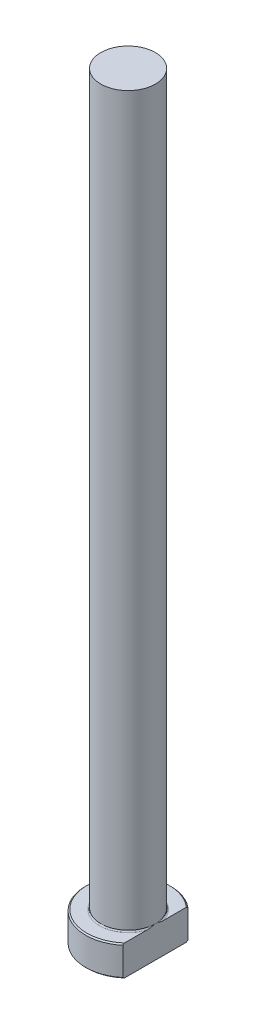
SolidWorks part; units mm, degrees
ref_plane "Front Plane" through (0, 0, 0) normal (0, 0, 1) x (1, 0, 0)
ref_plane "Top Plane" through (0, 0, 0) normal (0, 1, 0) x (1, 0, 0)
ref_plane "Right Plane" through (0, 0, 0) normal (1, 0, 0) x (0, 0, -1)
sketch "Sketch1" plane through (0, 0, 0) normal (0, 0, 1) x (1, 0, 0)
  line L0 (0, 259.9588) -> (0, -15.1925) construction
  line L1 (0, 0) -> (-7, 0)
  line L2 (-7, 0) -> (-7, 5)
  line L3 (-7, 5) -> (-4.5, 5)
  line L4 (-4.5, 5) -> (-4.5, 125)
  line L5 (-4.5, 125) -> (0, 125)
  line L6 (0, 125) -> (0, 0)
  dimension "L" = 125
  dimension "H" = 14
  dimension "T" = 5
  dimension "D" = 9
revolve "Revolve1" add sketch "Sketch1" angle 360 about L0
chamfer "Chamfer1" distance 0.2 angle 45 2 edges at (0, 5, 7) (0, 0, 7)
fillet "Fillet1" radius 0.2 1 edges at (0, 5, 4.5)
sketch "Sketch2" plane through (0, 0, 0) normal (0, 1, 0) x (1, 0, 0)
  line L0 (4.5, 5.3619) -> (4.5, -5.3619)
  circle A0 centre (0, 0) radius 7 construction
  arc A1 (4.5, -5.3619) -> (4.5, 5.3619) centre (0, 0) ccw
  circle A2 centre (0, 0) radius 4.5 construction
extrude "KEY" cut sketch "Sketch2" along normal through all
